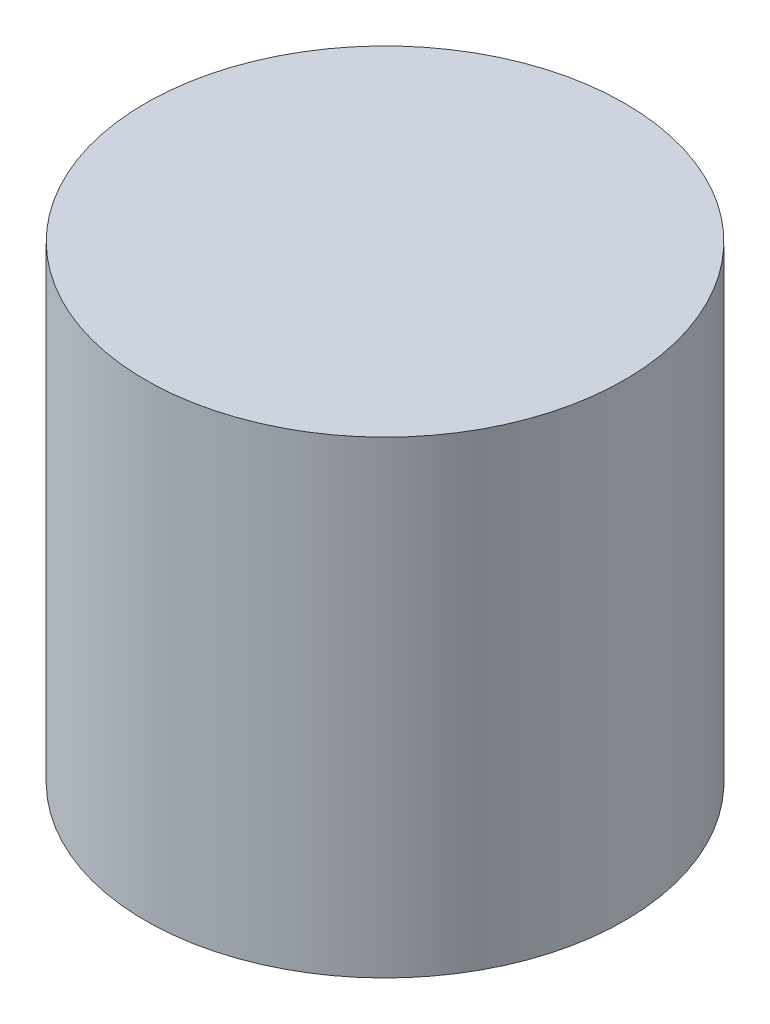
SolidWorks part; units mm, degrees
ref_plane "Front Plane" through (0, 0, 0) normal (0, 0, 1) x (1, 0, 0)
ref_plane "Top Plane" through (0, 0, 0) normal (0, 1, 0) x (1, 0, 0)
ref_plane "Right Plane" through (0, 0, 0) normal (1, 0, 0) x (0, 0, -1)
sketch "Sketch1" plane through (0, 0, 0) normal (0, 1, 0) x (1, 0, 0)
  circle A0 centre (0, 0) radius 38.9821
extrude "Boss-Extrude1" add sketch "Sketch1" along normal blind 76.2
